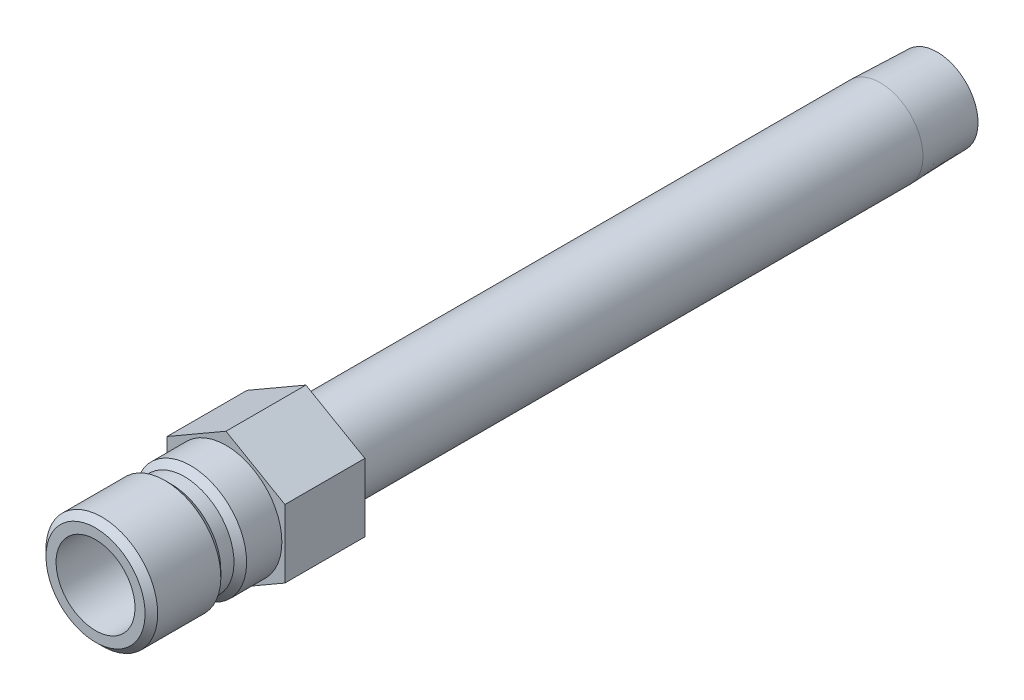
SolidWorks part; units mm, degrees
ref_plane "Front Plane" through (0, 0, 0) normal (0, 0, 1) x (1, 0, 0)
ref_plane "Top Plane" through (0, 0, 0) normal (0, 1, 0) x (1, 0, 0)
ref_plane "Right Plane" through (0, 0, 0) normal (1, 0, 0) x (0, 0, -1)
sketch "Sketch1" plane through (0, 0, 0) normal (1, 0, 0) x (0, 0, -1)
  line L0 (9.652, 0) -> (-18.923, 0) construction
  line L1 (-15.748, 4.7625) -> (-15.748, 5.9817)
  line L2 (-6.604, 5.9817) -> (-6.604, 0) construction
  line L3 (-14.986, 6.7437) -> (-7.366, 6.7437)
  line L4 (9.652, 5.1435) -> (9.652, 0) construction
  line L5 (-6.604, 5.9817) -> (-5.0165, 5.9817)
  line L6 (-4.2545, 6.7437) -> (9.652, 6.7437)
  line L7 (9.652, 6.7437) -> (9.652, 5.1435)
  line L8 (-6.604, 5.9817) -> (-7.366, 6.7437)
  line L9 (-5.0165, 5.9817) -> (-4.2545, 6.7437)
  line L10 (-15.748, 5.9817) -> (-14.986, 6.7437)
  line L11 (-15.748, 4.7625) -> (-3.556, 4.7625)
  line L12 (9.652, 5.1435) -> (78.994, 5.1435)
  line L13 (78.994, 5.1435) -> (85.852, 4.9292)
  line L14 (85.852, 4.9292) -> (85.852, 3.4163)
  line L15 (0, 0) -> (0, 6.7437) construction
  line L16 (9.652, 6.731) -> (9.652, 0) construction
  line L17 (-3.556, 4.7625) -> (-2.8402, 3.4163)
  line L19 (-2.8402, 3.4163) -> (85.852, 3.4163)
  dimension "D2" = 1.5875
  dimension "D3" = 0.762
  dimension "D4" = 45
  dimension "D5" = 9.144
  dimension "D6" = 45
  dimension "D7" = 1.79
  dimension "D8" = 6.858
  dimension "D9" = 101.6
  dimension "D10" = 3.175
  dimension "D11" = 9.525
  dimension "D12" = 10.287
  dimension "D13" = 25.4
  dimension "D14" = 13.4874
  dimension "D15" = 6.8326
  dimension "D16" = 12.192
  dimension "D17" = 9.652
  dimension "D18" = 118
revolve "Revolve1" add sketch "Sketch1" angle 360 about L0
sketch "Sketch2" plane through (0, 0, 0) normal (0, 0, 1) x (1, 0, 0)
  line L1 (-7.112, 4.1061) -> (-7.112, -4.1061)
  line L2 (-7.112, -4.1061) -> (0, -8.2122)
  line L3 (0, -8.2122) -> (7.112, -4.1061)
  line L4 (7.112, -4.1061) -> (7.112, 4.1061)
  line L5 (7.112, 4.1061) -> (0, 8.2122)
  line L6 (0, 8.2122) -> (-7.112, 4.1061)
  circle A0 centre (0, 0) radius 7.112 construction
  circle A1 centre (0, 0) radius 4.7625 construction
  circle A2 centre (0, 0) radius 4.7625
  dimension "D1" = 14.224
extrude "Boss-Extrude1" add sketch "Sketch2" against normal up to vertex (9.652 mm away)
